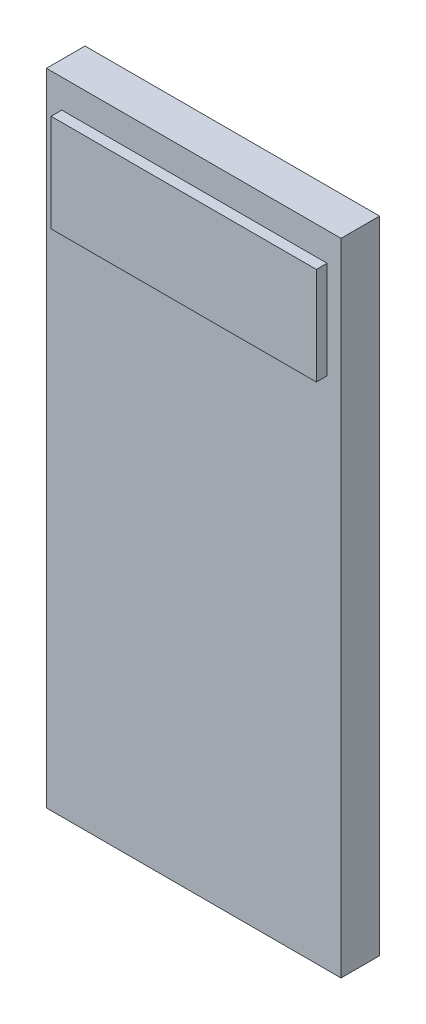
SolidWorks part; units mm, degrees
ref_plane "Plan de face" through (0, 0, 0) normal (0, 0, 1) x (1, 0, 0)
ref_plane "Plan de dessus" through (0, 0, 0) normal (0, 1, 0) x (1, 0, 0)
ref_plane "Plan de droite" through (0, 0, 0) normal (1, 0, 0) x (0, 0, -1)
sketch "Esquisse1" plane through (0, 0, 0) normal (0, 0, 1) x (1, 0, 0)
  line L0 (7.1, 44.4) -> (7.1, 19.4) construction
  line L1 (7.1, 47) -> (-7.15, 47) construction
  line L2 (-7.15, 19.4) -> (-7.15, 44.4) construction
  line L3 (7.1, 16.6) -> (-7.15, 16.6) construction
  line L4 (7.1, 47) -> (7.1, 16.6) construction
  line L5 (7.1, 47) -> (-7.15, 47) construction
  line L6 (-7.15, 16.6) -> (-7.15, 47) construction
  line L7 (7.1, 16.6) -> (-7.15, 16.6) construction
  line L8 (6.85, 46.75) -> (6.85, 16.85)
  line L9 (6.85, 16.85) -> (-6.9, 16.85)
  line L10 (-6.9, 16.85) -> (-6.9, 46.75)
  line L11 (6.85, 46.75) -> (-6.9, 46.75)
  dimension "D1" = 0.25
extrude "Extrusion1" add sketch "Esquisse1" along normal up to surface (1.8 mm away)
sketch "Esquisse3" plane through (0, 0, 1.8) normal (0, 0, 1) x (1, 0, 0)
  line L1 (-6.1837, 45.4179) -> (6.1995, 45.4179)
  line L2 (-6.1837, 45.4179) -> (-6.1837, 40.8666)
  line L3 (-6.1837, 40.8666) -> (6.1995, 40.8666)
  line L4 (6.1995, 45.4179) -> (6.1995, 40.8666)
extrude "Extrusion2" add sketch "Esquisse3" along normal blind 0.5
